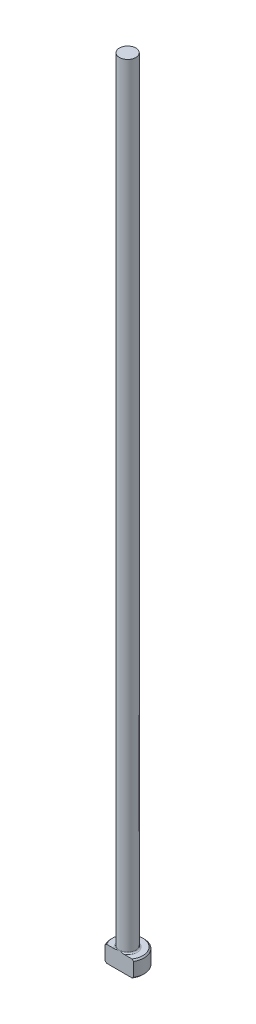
SolidWorks part; units mm, degrees
ref_plane "Front Plane" through (0, 0, 0) normal (0, 0, 1) x (1, 0, 0)
ref_plane "Top Plane" through (0, 0, 0) normal (0, 1, 0) x (1, 0, 0)
ref_plane "Right Plane" through (0, 0, 0) normal (1, 0, 0) x (0, 0, -1)
sketch "Sketch1" plane through (0, 0, 0) normal (0, 0, 1) x (1, 0, 0)
  line L0 (0, 259.9588) -> (0, -15.1925) construction
  line L1 (0, 0) -> (-3.175, 0)
  line L2 (-3.175, 0) -> (-3.175, 3.175)
  line L3 (-3.175, 3.175) -> (-1.5875, 3.175)
  line L4 (-1.5875, 3.175) -> (-1.5875, 152.4)
  line L5 (-1.5875, 152.4) -> (0, 152.4)
  line L6 (0, 152.4) -> (0, 0)
  dimension "L" = 152.4
  dimension "H" = 6.35
  dimension "T" = 3.175
  dimension "D" = 3.175
revolve "Revolve1" add sketch "Sketch1" angle 360 about L0
chamfer "Chamfer1" distance 0.254 angle 45 2 edges at (0, 3.175, 3.175) (0, 0, 3.175)
fillet "Fillet1" radius 0.254 1 edges at (0, 3.175, 1.5875)
sketch "Sketch2" plane through (0, 0, 0) normal (0, -1, 0) x (1, 0, 0)
  line L0 (-2.7496, 1.5875) -> (2.7496, 1.5875)
  arc A0 (2.7496, 1.5875) -> (-2.7496, 1.5875) centre (0, 0) ccw
  circle A1 centre (0, 0) radius 3.175 construction
  circle A3 centre (0, 0) radius 1.5875 construction
extrude "KEY" cut sketch "Sketch2" against normal through all
sketch "Pocket Sketch" plane through (0, 0, 0) normal (0, 0, 1) x (1, 0, 0)
  line L0 (-3.5719, 0) -> (-3.5719, 3.2004)
  line L1 (-3.5719, 3.2004) -> (-2.5479, 3.2004)
  line L2 (-1.7859, 3.9624) -> (-1.7859, 22.225)
  line L3 (-1.7859, 22.225) -> (0, 22.225)
  line L4 (0, 22.225) -> (0, 0)
  line L5 (0, 0) -> (-3.5719, 0)
  line L6 (0, 12.6104) -> (0, -2.4989) construction
  line L7 (-3.175, 2.921) -> (-3.175, 0.254) construction
  line L8 (2.921, 3.175) -> (-2.921, 3.175) construction
  line L9 (-1.5875, 152.4) -> (-1.5875, 3.429) construction
  line L10 (-2.5479, 3.2004) -> (-1.7859, 3.9624)
  point P3 (-1.7859, 3.2004)
  dimension "D1" = 7.1437
  dimension "D2" = 0.3969
  dimension "D3" = 0.0254
  dimension "D4" = 0.1984
  dimension "D5" = 3.5719
  dimension "D6" = 22.225
